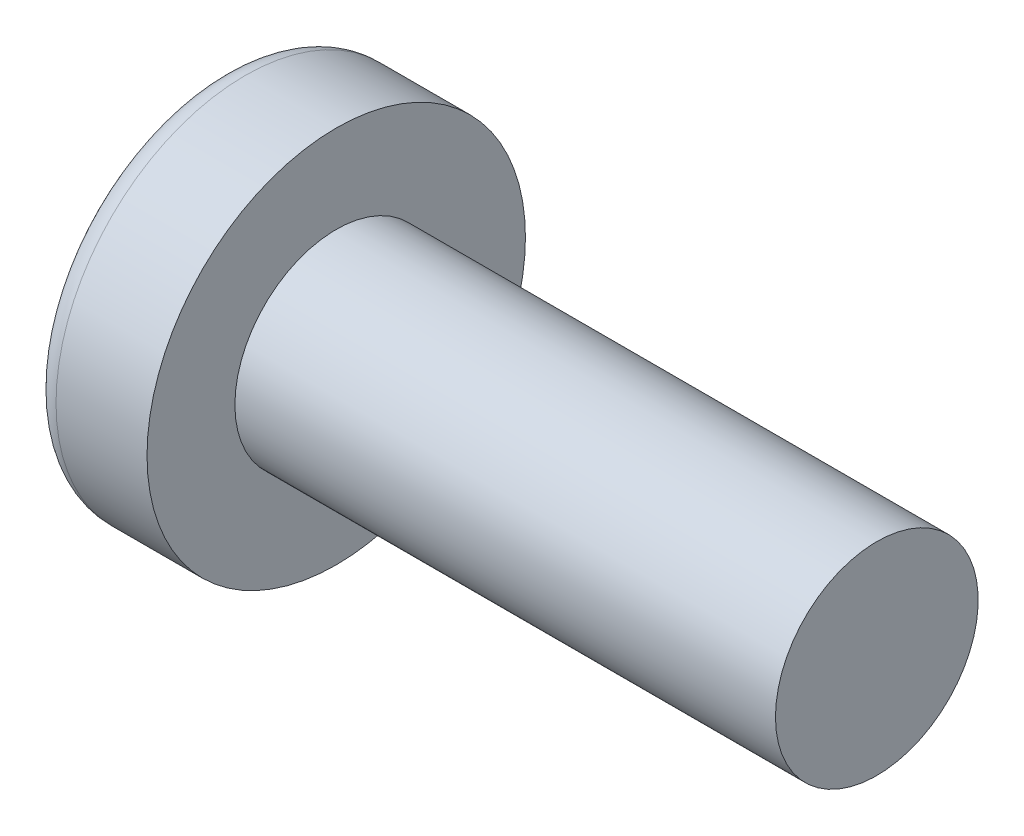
SolidWorks part; units mm, degrees
ref_plane "Plane1" through (0, 0, 0) normal (0, 0, 1) x (1, 0, 0)
ref_plane "Plane2" through (0, 0, 0) normal (0, 1, 0) x (1, 0, 0)
ref_plane "Plane3" through (0, 0, 0) normal (1, 0, 0) x (0, 0, -1)
revolve "Base-Revolve" add sketch "BodySke" angle 360 about L2
sketch "BodySke" plane through (0, 0, 0) normal (0, 0, 1) x (1, 0, 0)
  line L0 (2.4, 1.5) -> (2.4, 2.8)
  line L1 (2.9, 6.35) -> (2.9, -3.175) construction
  line L2 (-25.4, 0) -> (127, 0) construction
  line L3 (10.4, 0) -> (0, 0)
  line L4 (2.4, 1.5) -> (10.4, 1.5)
  line L5 (10.4, 1.5) -> (10.4, 0)
  line L6 (1.0534, 2.8) -> (2.4, 2.8)
  line L7 (2.4, -1.5) -> (10.4, -1.5) construction
  line L8 (2.4, 6.35) -> (2.4, -3.175) construction
  arc A0 (0.7472, 2.6293) -> (0, 0) centre (5, 0) ccw
  arc A2 (0.7472, 2.6293) -> (1.0534, 2.8) centre (1.0534, 2.44) cw
  dimension "Head_fillet_rad" = 0.36
  dimension "Head_crown_rad" = 5
  dimension "Head_ht" = 2.4
  dimension "Diameter" = 3
  dimension "Length" = 8
  dimension "Head_dia" = 5.6
  dimension "Advance" = 0.5
  dimension "Thread_nom" = 8
sketch "Sketch3" plane through (0, 0, 0) normal (1, 0, 0) x (0, 0, -1)
  line L0 (0.37, -1.45) -> (-0.37, -1.45)
  line L1 (0.37, -1.45) -> (0.37, 1.45)
  line L2 (-0.37, 1.45) -> (0.37, 1.45)
  line L3 (-0.37, 1.45) -> (-0.37, -1.45)
  dimension "D1" = 1.45
  dimension "Cross_dia" = 2.9
  dimension "D2" = 0.37
  dimension "Cross_width" = 0.74
ref_plane "Plane4" through (1.76, 0, 0) normal (1, 0, 0) x (0, 0, -1)
sketch "Sketch4" plane through (1.76, 0, 0) normal (1, 0, 0) x (0, 0, -1)
  line L0 (0.185, -0.185) -> (-0.185, -0.185)
  line L1 (0.185, -0.185) -> (0.185, 0.185)
  line L2 (-0.185, 0.185) -> (0.185, 0.185)
  line L3 (-0.185, 0.185) -> (-0.185, -0.185)
  dimension "D1" = 0.37
  dimension "D2" = 0.37
  dimension "D3" = 0.185
  dimension "D4" = 0.185
loft "Cut-Loft1" cut profiles "Sketch3", "Sketch4"
pattern_circular "CirPattern1" count 2 every 90 about axis through (0, 0, 0) along (1, 0, 0) of "Cut-Loft1"
sketch "ThdSchSke" plane through (0, 0, 0) normal (0, 0, 1) x (1, 0, 0)
  line L0 (2.9, -1.2195) -> (2.7036, -1.5)
  line L1 (2.9, -1.2195) -> (3.0964, -1.5)
  line L2 (3.0964, -1.5) -> (3.0964, -1.875)
  line L3 (-3.175, 0) -> (5.1513, 0) construction
  line L5 (3.0964, -1.875) -> (2.7036, -1.875)
  line L6 (2.7036, -1.875) -> (2.7036, -1.5)
  dimension "Thread_minor" = 2.439
  dimension "Diameter" = 3
  dimension "Start" = 2.9
  dimension "SideAngle" = 55
  dimension "VeeAngle" = 70
  dimension "Overcut" = 3.75
revolve "ThreadSchematic" [suppressed] cut sketch "ThdSchSke" angle 360 about L3
pattern_linear "ThdSchPat" [suppressed]
equation "\"D1@Sketch3\" = \"Cross_dia@Sketch3\" / 2"
equation "\"D2@Sketch3\" = \"Cross_width@Sketch3\" / 2"
equation "\"D1@Sketch4\" = \"Cross_width@Sketch3\" *.5"
equation "\"D2@Sketch4\" = \"D1@Sketch4\""
equation "\"D3@Sketch4\" = \"D1@Sketch4\" / 2"
equation "\"D4@Sketch4\" = \"D2@Sketch4\" / 2"
equation "\"Thread_length@ThreadCosmetic\" = ((sgn( (\"Length@BodySke\" - \"Advance@BodySke\" ) - \"Thread_nom@BodySke\" )-1)*( (\"Length@BodySke\" - \"Advance@BodySke\" ) - \"Thread_nom@BodySke\" ))/-2+ \"Thread_nom@BodySke\""
equation "\"Thread_minor@ThdSchSke\" = \"Thread_minor@ThreadCosmetic\""
equation "\"Diameter@ThdSchSke\" = \"Diameter@BodySke\""
equation "\"Overcut@ThdSchSke\" = \"Diameter@BodySke\" * 1.25"
equation "\"Start@ThdSchSke\" = \"Head_ht@BodySke\" + \"Length@BodySke\" - \"Thread_length@ThreadCosmetic\"  '---Non-countersunk---"
equation "\"Num_threads@ThdSchPat\" = int( \"Thread_length@ThreadCosmetic\" / \"Advance@BodySke\" + 0.999 )  + 1"
equation "\"Advance@ThdSchPat\" = \"Thread_length@ThreadCosmetic\" /  (\"Num_threads@ThdSchPat\" - 1) 'relax it"
